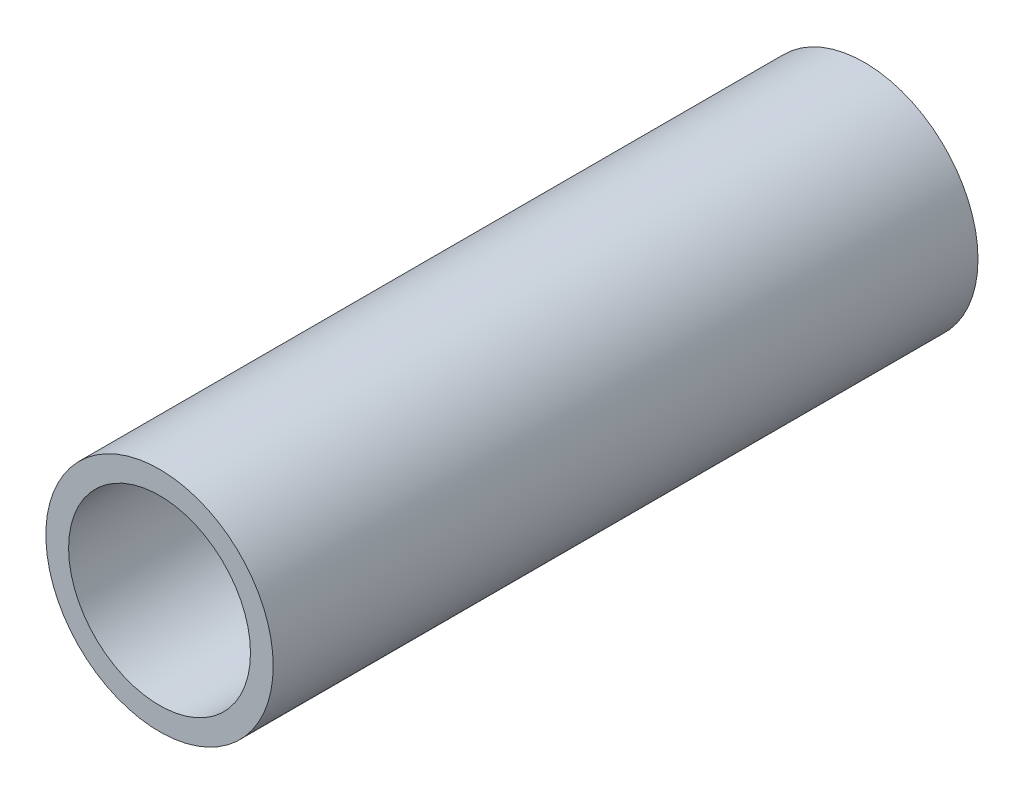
SolidWorks part; units mm, degrees
ref_plane "Спереди" through (0, 0, 0) normal (0, 0, 1) x (1, 0, 0)
ref_plane "Сверху" through (0, 0, 0) normal (0, 1, 0) x (1, 0, 0)
ref_plane "Справа" through (0, 0, 0) normal (1, 0, 0) x (0, 0, -1)
sketch "Эскиз1" plane through (0, 0, 0) normal (0, 0, 1) x (1, 0, 0)
  circle A0 centre (0, 0) radius 4
  circle A1 centre (0, 0) radius 5
  dimension "D1" = 8
  dimension "D2" = 10
extrude "Бобышка-Вытянуть1" add sketch "Эскиз1" along normal blind 31
